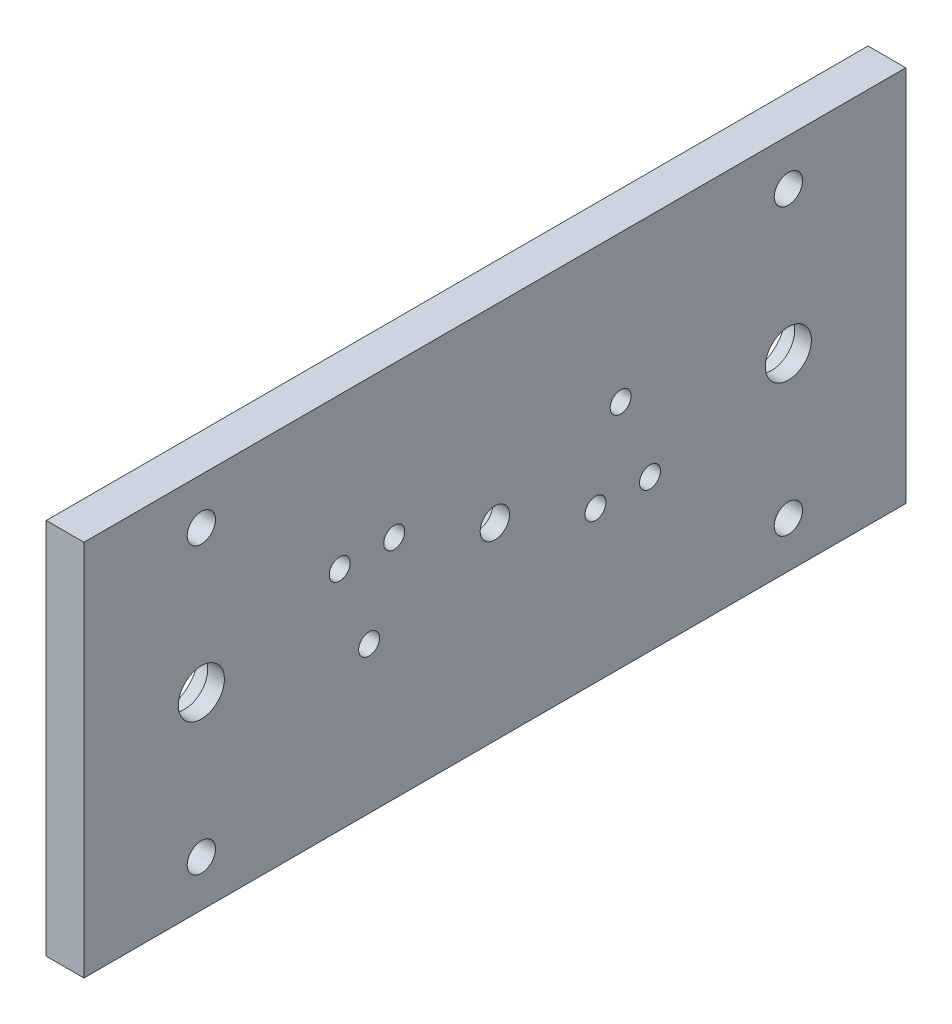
SolidWorks part; units mm, degrees
ref_plane "Face" through (0, 0, 0) normal (0, 0, 1) x (1, 0, 0)
ref_plane "Dessus" through (0, 0, 0) normal (0, 1, 0) x (1, 0, 0)
ref_plane "Droite" through (0, 0, 0) normal (1, 0, 0) x (0, 0, -1)
imported_body "Importée1"
sketch "Esquisse1" plane through (-119, 0, 0) normal (1, 0, 0) x (0, 0, -1)
  line L0 (0, 78) -> (-196, 78) construction
  line L1 (0, 123) -> (0, 33) construction
  line L2 (-196, 33) -> (-196, 123) construction
  line L3 (-98, 123) -> (-98, 33) construction
  line L4 (-196, 123) -> (0, 123) construction
  line L5 (0, 33) -> (-196, 33) construction
  circle A0 centre (-98, 78) radius 3.5
  circle A1 centre (-135, 87) radius 2.5
  circle A2 centre (-122, 87) radius 2.5
  circle A3 centre (-128, 68) radius 2.5
  circle A4 centre (-68, 88) radius 2.5
  circle A5 centre (-74, 69) radius 2.5
  circle A6 centre (-61, 69) radius 2.5
  dimension "D1" = 7
  dimension "D2" = 5
  dimension "D3" = 24
  dimension "D4" = 30
  dimension "D5" = 37
  dimension "D6" = 24
  dimension "D7" = 30
  dimension "D8" = 37
  dimension "D9" = 9
  dimension "D10" = 9
  dimension "D11" = 10
  dimension "D12" = 9
  dimension "D13" = 9
  dimension "D14" = 10
extrude "Enlèv. mat.-Extru.1" cut sketch "Esquisse1" against normal through all
sketch "Esquisse2" plane through (-128, 0, 0) normal (-1, 0, 0) x (0, 0, 1)
  circle A0 centre (135, 87) radius 4.5
  circle A1 centre (122, 87) radius 4.5
  circle A2 centre (128, 68) radius 4.5
  circle A3 centre (74, 69) radius 4.5
  circle A4 centre (61, 69) radius 4.5
  circle A5 centre (68, 88) radius 4.5
  dimension "D1" = 9
extrude "Enlèv. mat.-Extru.2" cut sketch "Esquisse2" against normal blind 3
sketch "Esquisse3" plane through (-128, 0, 0) normal (-1, 0, 0) x (0, 0, 1)
  circle A0 centre (98, 78) radius 6.5
  dimension "D1" = 13
extrude "Enlèv. mat.-Extru.3" cut sketch "Esquisse3" against normal blind 5
sketch "Esquisse4" plane through (-128, 0, 0) normal (-1, 0, 0) x (0, 0, 1)
  circle A0 centre (168, 78) radius 5.5
  circle A1 centre (28, 78) radius 5.5
  dimension "D1" = 11
  dimension "D2" = 70
  dimension "D3" = 70
extrude "Enlèv. mat.-Extru.4" cut sketch "Esquisse4" against normal through all
sketch "Esquisse5" plane through (-128, 0, 0) normal (-1, 0, 0) x (0, 0, 1)
  circle A0 centre (168, 78) radius 8.5
  circle A1 centre (28, 78) radius 8.5
  dimension "D1" = 17
extrude "Enlèv. mat.-Extru.5" cut sketch "Esquisse5" against normal blind 5
